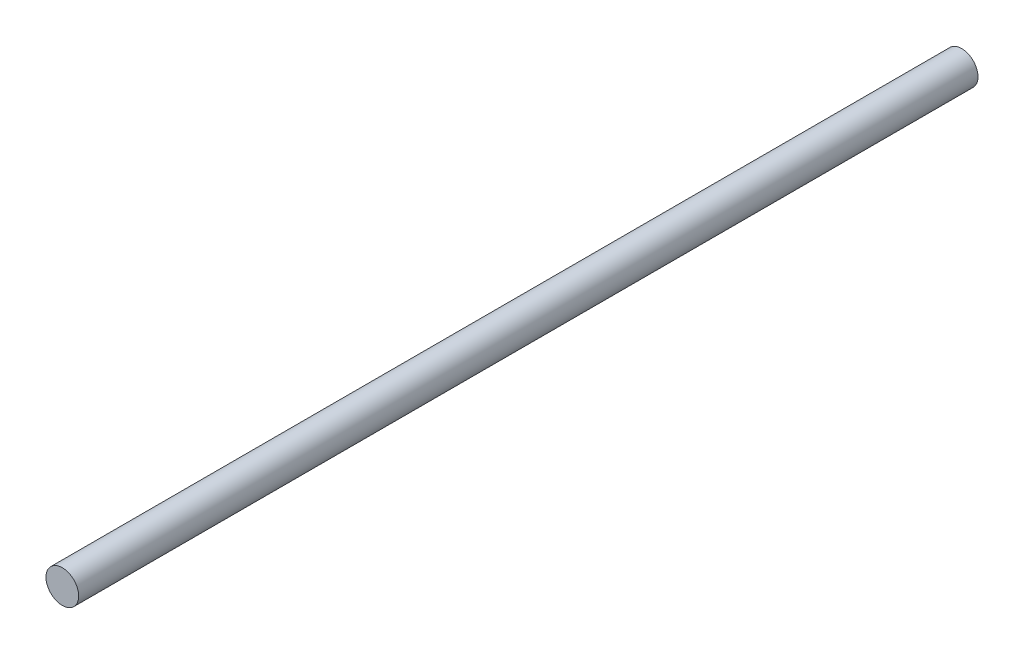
SolidWorks part; units mm, degrees
ref_plane "Front Plane" through (0, 0, 0) normal (0, 0, 1) x (1, 0, 0)
ref_plane "Top Plane" through (0, 0, 0) normal (0, 1, 0) x (1, 0, 0)
ref_plane "Right Plane" through (0, 0, 0) normal (1, 0, 0) x (0, 0, -1)
sketch "Sketch1" plane through (0, 0, 0) normal (0, 0, 1) x (1, 0, 0)
  circle A0 centre (0, 0) radius 30
  dimension "D1" = 60
extrude "Boss-Extrude1" add sketch "Sketch1" against normal blind 1650
